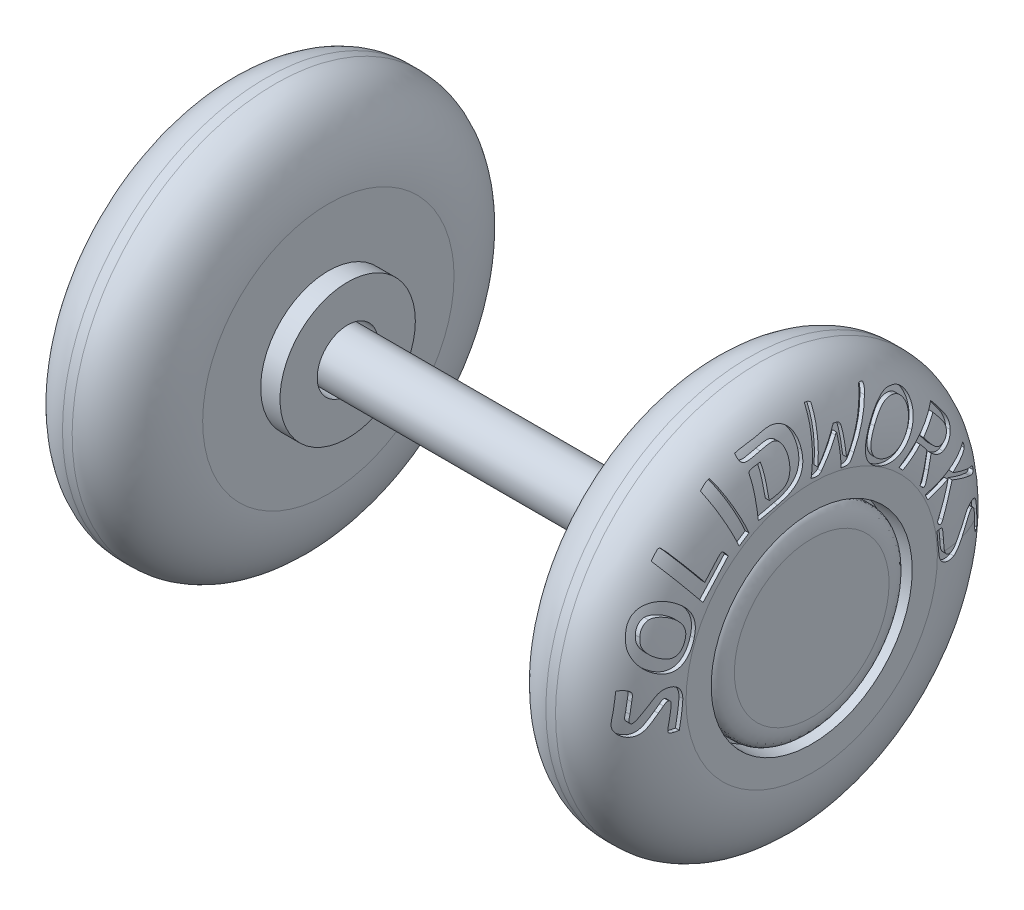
SolidWorks part; units mm, degrees
ref_plane "Front Plane" through (0, 0, 0) normal (0, 0, 1) x (1, 0, 0)
ref_plane "Top Plane" through (0, 0, 0) normal (0, 1, 0) x (1, 0, 0)
ref_plane "Right Plane" through (0, 0, 0) normal (1, 0, 0) x (0, 0, -1)
sketch "Sketch1" plane through (0, 0, 0) normal (1, 0, 0) x (0, 0, -1)
  circle A0 centre (0, 0) radius 1.375
  dimension "D1" = 2.75
extrude "Boss-Extrude1" add sketch "Sketch1" along normal mid plane 31
sketch "Sketch2" plane through (15.5, 0, 0) normal (1, 0, 0) x (0, 0, -1)
  circle A1 centre (0, 0) radius 5
  dimension "D1" = 10
extrude "Boss-Extrude2" add sketch "Sketch2" against normal blind 1
sketch "Sketch3" plane through (-15.5, 0, 0) normal (-1, 0, 0) x (0, 0, 1)
  circle A1 centre (0, 0) radius 5
  circle A2 centre (0, 0) radius 5
  dimension "D1" = 0
extrude "Boss-Extrude3" add sketch "Sketch3" against normal blind 1
fillet "Fillet2" radius 1 2 edges at (-15.5, 0, 5) (15.5, 0, -5)
sketch "Sketch4" plane through (0, 0, 0) normal (0, 1, 0) x (1, 0, 0)
  line L0 (0, 0) -> (0, 7.0257) construction
  line L1 (-15.5, 5.2) -> (-15.5, 10.5)
  line L2 (-14.3, 5.2) -> (-14.3, 1.575)
  line L3 (-15.5, 10.5) -> (-9.5, 10.5)
  line L4 (-9.5, 10.5) -> (-9.5, 3.5)
  line L5 (-9.5, 3.5) -> (-8.5, 3.5)
  line L6 (-8.5, 3.5) -> (-8.5, 1.575)
  line L7 (-8.5, 1.575) -> (-14.3, 1.575)
  line L8 (14.5, 1.375) -> (-14.5, 1.375) construction
  line L10 (-15.5, 5.2) -> (-14.3, 5.2)
  line L11 (-14.5, 5) -> (-15, 5) construction
  line L12 (-14.5, -5) -> (-14.5, 5) construction
  line L13 (9.5, 3.5) -> (8.5, 3.5)
  line L14 (9.5, 10.5) -> (9.5, 3.5)
  line L15 (15.5, 10.5) -> (9.5, 10.5)
  line L16 (15.5, 5.2) -> (15.5, 10.5)
  line L17 (15.5, 5.2) -> (14.3, 5.2)
  line L18 (14.3, 5.2) -> (14.3, 1.575)
  line L19 (8.5, 1.575) -> (14.3, 1.575)
  line L20 (8.5, 3.5) -> (8.5, 1.575)
  line L21 (14.5, 0) -> (-14.5, 0) construction
  dimension "D1" = 0.2
  dimension "D2" = 10.5
  dimension "D3" = 6
  dimension "D4" = 1
  dimension "D5" = 3.5
  dimension "D6" = 0.2
  dimension "D7" = 0.2
  dimension "D8" = 1.2
revolve "Revolve1" add sketch "Sketch4" angle 360 about axis through (15.5, 0, 0) along (-1, 0, 0)
fillet "Fillet3" radius 4 2 edges at (-9.5, 0, -10.5) (-15.5, 0, -10.5)
fillet "Fillet4" radius 4 2 edges at (15.5, 0, -10.5) (9.5, 0, -10.5)
sketch "Sketch6" plane through (15.5, 0, 0) normal (1, 0, 0) x (0, 0, -1)
  line L0 (6.1029, 4.8255) -> (5.607, 3.5743)
  line L1 (-7.0613, -1.1466) -> (-6.8336, -1.1723)
  line L2 (0.511, 6.7706) -> (1.4142, 7.8418)
  line L3 (1.5075, 7.913) -> (1.5267, 6.413)
  line L4 (2.2065, 6.7495) -> (3.3789, 8.4376)
  line L5 (0.3417, 7.0341) -> (0.7813, 9.3258)
  line L6 (0.496, 9.4168) -> (-0.0257, 6.7157)
  line L7 (-5.6069, 3.944) -> (-4.3068, 5.3711)
  line L8 (-5.4773, 4.7616) -> (-6.5379, 6.1298)
  line L9 (-6.7061, 6.3517) -> (-6.8957, 6.5602)
  line L10 (-6.8957, 6.5602) -> (-6.9585, 6.5541)
  line L11 (5.88, 3.018) -> (5.9991, 2.7442)
  line L12 (7.4614, 2.8066) -> (8.7831, 2.1168)
  line L13 (-3.7484, 5.5397) -> (-3.2376, 5.8749)
  line L14 (-4.8596, 8.1146) -> (-3.7484, 5.5397)
  spline S0 degree 3 poles (0.3992, -10.4925) (-5.3947, -10.736) (-10.2888, -6.2365) (-10.5322, -0.4425) knots 0.75 0.75 0.75 0.75 1 1 1 1 construction
  spline S1 degree 3 poles (10.4492, 0.4389) (10.6927, -5.355) (6.1932, -10.2491) (0.3992, -10.4925) knots 0.5 0.5 0.5 0.5 0.75 0.75 0.75 0.75 construction
  spline S2 degree 3 poles (-0.4822, 10.4889) (5.3117, 10.7324) (10.2058, 6.2329) (10.4492, 0.4389) knots 0.25 0.25 0.25 0.25 0.5 0.5 0.5 0.5 construction
  spline S3 degree 3 poles (-10.5322, -0.4425) (-10.7757, 5.3514) (-6.2762, 10.2455) (-0.4822, 10.4889) knots 0 0 0 0 0.25 0.25 0.25 0.25 construction
  spline S4 degree 3 poles (-6.9179, 4.4597) (-7.7414, 4.9473) (-8.523, 4.5972) (-8.7241, 3.6617) knots 0.8 0.8 0.8 0.8 1 1 1 1
  spline S5 degree 3 poles (-6.0745, 2.5995) (-5.8601, 3.4074) (-6.2269, 4.0504) (-6.9179, 4.4597) knots 0.6 0.6 0.6 0.6 0.8 0.8 0.8 0.8
  spline S6 degree 3 poles (-7.8878, 1.7969) (-7.0077, 1.2979) (-6.3236, 1.6614) (-6.0745, 2.5995) knots 0.4 0.4 0.4 0.4 0.6 0.6 0.6 0.6
  spline S7 degree 3 poles (-8.6485, 2.5847) (-8.5019, 2.2707) (-8.2352, 1.994) (-7.8878, 1.7969) knots 0.2 0.2 0.2 0.2 0.4 0.4 0.4 0.4
  spline S8 degree 3 poles (-8.7241, 3.6617) (-8.821, 3.2108) (-8.818, 2.9476) (-8.6485, 2.5847) knots 0 0 0 0 0.2 0.2 0.2 0.2
  spline S9 degree 3 poles (-7.9008, 4.0439) (-8.1052, 3.9583) (-8.261, 3.69) (-8.2994, 3.4278) knots 0.833333 0.833333 0.833333 0.833333 1 1 1 1
  spline S10 degree 3 poles (-6.4874, 2.8623) (-6.3644, 3.63) (-7.4779, 4.2209) (-7.9008, 4.0439) knots 0.666667 0.666667 0.666667 0.666667 0.833333 0.833333 0.833333 0.833333
  spline S11 degree 3 poles (-6.8897, 2.2194) (-6.6867, 2.3078) (-6.5303, 2.5942) (-6.4874, 2.8623) knots 0.5 0.5 0.5 0.5 0.666667 0.666667 0.666667 0.666667
  spline S12 degree 3 poles (-7.629, 2.3456) (-7.3667, 2.2084) (-7.1174, 2.1202) (-6.8897, 2.2194) knots 0.333333 0.333333 0.333333 0.333333 0.5 0.5 0.5 0.5
  spline S13 degree 3 poles (-8.1719, 2.792) (-8.0557, 2.6249) (-7.8439, 2.4579) (-7.629, 2.3456) knots 0.166667 0.166667 0.166667 0.166667 0.333333 0.333333 0.333333 0.333333
  spline S14 degree 3 poles (-8.2994, 3.4278) (-8.341, 3.1427) (-8.3233, 3.01) (-8.1719, 2.792) knots 0 0 0 0 0.166667 0.166667 0.166667 0.166667
  spline S15 degree 3 poles (5.4074, 6.0703) (5.986, 6.7608) (5.869, 7.6502) (5.0413, 7.9491) knots 0.75 0.75 0.75 0.75 1 1 1 1
  spline S16 degree 3 poles (3.5458, 5.4835) (4.2414, 5.1853) (4.9379, 5.5104) (5.4074, 6.0703) knots 0.5 0.5 0.5 0.5 0.75 0.75 0.75 0.75
  spline S17 degree 3 poles (4.0176, 7.9739) (2.9679, 7.6122) (2.1543, 6.08) (3.5458, 5.4835) knots 0.25 0.25 0.25 0.25 0.5 0.5 0.5 0.5
  spline S18 degree 3 poles (5.0413, 7.9491) (4.6119, 8.1045) (4.3605, 8.0924) (4.0176, 7.9739) knots 0 0 0 0 0.25 0.25 0.25 0.25
  spline S19 degree 3 poles (5.4625, 7.0721) (5.4229, 7.3275) (5.2252, 7.5856) (4.9157, 7.6902) knots 0.75 0.75 0.75 0.75 1 1 1 1
  spline S20 degree 3 poles (3.4457, 7.2301) (2.947, 6.6776) (2.9844, 6.0342) (3.6777, 5.7363) (4.6028, 5.3388) (5.562, 6.4291) (5.4625, 7.0721) knots 0.25 0.25 0.25 0.25 0.5 0.5 0.5 0.75 0.75 0.75 0.75
  spline S21 degree 3 poles (4.9157, 7.6902) (4.3046, 7.8966) (3.8526, 7.6813) (3.4457, 7.2301) knots 0 0 0 0 0.25 0.25 0.25 0.25
  spline S22 degree 3 poles (-1.1046, 7.2957) (-1.294, 6.9059) (-1.6495, 6.8612) (-2.1568, 6.773) knots 0.916667 0.916667 0.916667 0.916667 1 1 1 1
  spline S23 degree 3 poles (-1.0506, 8.4509) (-0.925, 8.0791) (-0.9739, 7.5648) (-1.1046, 7.2957) knots 0.833333 0.833333 0.833333 0.833333 0.916667 0.916667 0.916667 0.916667
  spline S24 degree 3 poles (-2.0955, 8.6969) (-1.6056, 8.8053) (-1.2185, 8.9481) (-1.0506, 8.4509) knots 0.75 0.75 0.75 0.75 0.833333 0.833333 0.833333 0.833333
  spline S25 degree 3 poles (-3.0944, 8.928) (-3.0893, 8.3452) (-2.6961, 8.564) (-2.0955, 8.6969) knots 0.666667 0.666667 0.666667 0.666667 0.75 0.75 0.75 0.75
  spline S26 degree 3 poles (-2.0868, 9.1595) (-2.3639, 9.0982) (-2.8492, 9.0203) (-3.0944, 8.928) knots 0.583333 0.583333 0.583333 0.583333 0.666667 0.666667 0.666667 0.666667
  spline S27 degree 3 poles (-1.1479, 9.2899) (-1.4363, 9.3273) (-1.7718, 9.2292) (-2.0868, 9.1595) knots 0.5 0.5 0.5 0.5 0.583333 0.583333 0.583333 0.583333
  spline S28 degree 3 poles (-0.3154, 8.0423) (-0.323, 8.7533) (-0.5581, 9.2134) (-1.1479, 9.2899) knots 0.416667 0.416667 0.416667 0.416667 0.5 0.5 0.5 0.5
  spline S29 degree 3 poles (-1.7636, 6.3938) (-0.8874, 6.5881) (-0.3044, 7.0044) (-0.3154, 8.0423) knots 0.333333 0.333333 0.333333 0.333333 0.416667 0.416667 0.416667 0.416667
  spline S30 degree 3 poles (-2.7479, 6.1817) (-2.4783, 6.2086) (-2.045, 6.3313) (-1.7636, 6.3938) knots 0.25 0.25 0.25 0.25 0.333333 0.333333 0.333333 0.333333
  spline S31 degree 3 poles (-2.8102, 7.7234) (-2.8023, 7.4534) (-2.7797, 6.2956) (-2.7479, 6.1817) knots 0.166667 0.166667 0.166667 0.166667 0.25 0.25 0.25 0.25
  spline S32 degree 3 poles (-2.241, 8.3428) (-2.9459, 8.2084) (-2.8266, 8.2783) (-2.8102, 7.7234) knots 0.083333 0.083333 0.083333 0.083333 0.166667 0.166667 0.166667 0.166667
  spline S33 degree 3 poles (-2.1568, 6.773) (-2.2239, 6.9953) (-2.1793, 8.0916) (-2.241, 8.3428) knots 0 0 0 0 0.083333 0.083333 0.083333 0.083333
  spline S34 degree 3 poles (4.5205, 4.9315) (4.5781, 4.856) (4.6436, 4.7606) (4.7071, 4.723) knots 0 0 0 0 0.090909 0.090909 0.090909 0.090909
  spline S35 degree 3 poles (4.7071, 4.723) (4.8292, 4.7508) (5.5778, 5.1717) (5.7563, 5.2738) knots 0.090909 0.090909 0.090909 0.090909 0.181818 0.181818 0.181818 0.181818
  spline S36 degree 3 poles (5.7563, 5.2738) (5.85, 5.1714) (6.0474, 4.9423) (6.1029, 4.8255) knots 0.181818 0.181818 0.181818 0.181818 0.272727 0.272727 0.272727 0.272727
  spline S37 degree 3 poles (5.607, 3.5743) (5.857, 3.2188) (5.887, 3.45) (6.086, 3.9827) knots 0.363636 0.363636 0.363636 0.363636 0.454545 0.454545 0.454545 0.454545
  spline S38 degree 3 poles (6.086, 3.9827) (6.1139, 4.0577) (6.2849, 4.5428) (6.3401, 4.5841) knots 0.454545 0.454545 0.454545 0.454545 0.545455 0.545455 0.545455 0.545455
  spline S39 degree 3 poles (6.3401, 4.5841) (6.5768, 4.3639) (6.7974, 4.2451) (7.0742, 4.2494) knots 0.545455 0.545455 0.545455 0.545455 0.636364 0.636364 0.636364 0.636364
  spline S40 degree 3 poles (7.0742, 4.2494) (7.3146, 4.2533) (7.6813, 4.3669) (7.8225, 4.651) knots 0.636364 0.636364 0.636364 0.636364 0.727273 0.727273 0.727273 0.727273
  spline S41 degree 3 poles (7.8225, 4.651) (7.9527, 4.9131) (7.8289, 5.1654) (7.6466, 5.4411) knots 0.727273 0.727273 0.727273 0.727273 0.818182 0.818182 0.818182 0.818182
  spline S42 degree 3 poles (7.6466, 5.4411) (7.5407, 5.6017) (7.131, 6.1415) (6.9928, 6.2663) knots 0.818182 0.818182 0.818182 0.818182 0.909091 0.909091 0.909091 0.909091
  spline S43 degree 3 poles (6.9928, 6.2663) (6.8208, 6.1817) (4.6651, 5.0454) (4.5205, 4.9315) knots 0.909091 0.909091 0.909091 0.909091 1 1 1 1
  spline S44 degree 3 poles (6.9166, 5.8843) (6.8467, 5.8739) (6.0979, 5.4779) (6.0149, 5.4092) knots 0.75 0.75 0.75 0.75 1 1 1 1
  spline S45 degree 3 poles (7.4391, 5.226) (7.2881, 5.4422) (7.088, 5.6812) (6.9166, 5.8843) knots 0.5 0.5 0.5 0.5 0.75 0.75 0.75 0.75
  spline S46 degree 3 poles (6.7909, 4.6031) (7.1974, 4.4198) (7.8197, 4.6811) (7.4391, 5.226) knots 0.25 0.25 0.25 0.25 0.5 0.5 0.5 0.5
  spline S47 degree 3 poles (6.0149, 5.4092) (6.2194, 5.1389) (6.5098, 4.7298) (6.7909, 4.6031) knots 0 0 0 0 0.25 0.25 0.25 0.25
  spline S48 degree 3 poles (-6.8336, -1.1723) (-6.7814, -0.9232) (-6.6579, -0.0611) (-6.6624, 0.1686) knots 0.058824 0.058824 0.058824 0.058824 0.117647 0.117647 0.117647 0.117647
  spline S49 degree 3 poles (-6.6624, 0.1686) (-6.6695, 0.5259) (-6.8522, 0.8552) (-7.224, 0.943) knots 0.117647 0.117647 0.117647 0.117647 0.176471 0.176471 0.176471 0.176471
  spline S50 degree 3 poles (-7.224, 0.943) (-7.8004, 1.0792) (-7.9809, 0.6757) (-8.463, 0.1744) knots 0.176471 0.176471 0.176471 0.176471 0.235294 0.235294 0.235294 0.235294
  spline S51 degree 3 poles (-8.463, 0.1744) (-8.5419, 0.0923) (-8.708, -0.1408) (-8.8313, -0.1444) knots 0.235294 0.235294 0.235294 0.235294 0.294118 0.294118 0.294118 0.294118
  spline S52 degree 3 poles (-8.8313, -0.1444) (-8.9505, -0.0578) (-8.8886, 0.1179) (-8.8658, 0.2914) knots 0.294118 0.294118 0.294118 0.294118 0.352941 0.352941 0.352941 0.352941
  spline S53 degree 3 poles (-8.8658, 0.2914) (-8.8423, 0.4704) (-8.8189, 0.6495) (-8.7953, 0.8285) knots 0.352941 0.352941 0.352941 0.352941 0.411765 0.411765 0.411765 0.411765
  spline S54 degree 3 poles (-8.7953, 0.8285) (-8.7706, 1.0162) (-8.7163, 1.159) (-8.8209, 1.268) knots 0.411765 0.411765 0.411765 0.411765 0.470588 0.470588 0.470588 0.470588
  spline S55 degree 3 poles (-8.8209, 1.268) (-8.9228, 1.3742) (-9.1168, 1.3875) (-9.2834, 1.3998) knots 0.470588 0.470588 0.470588 0.470588 0.529412 0.529412 0.529412 0.529412
  spline S56 degree 3 poles (-9.2834, 1.3998) (-9.3303, 1.1007) (-9.3649, 0.7939) (-9.4043, 0.4932) knots 0.529412 0.529412 0.529412 0.529412 0.588235 0.588235 0.588235 0.588235
  spline S57 degree 3 poles (-9.4043, 0.4932) (-9.4428, 0.1999) (-9.5281, -0.11) (-9.4075, -0.3409) knots 0.588235 0.588235 0.588235 0.588235 0.647059 0.647059 0.647059 0.647059
  spline S58 degree 3 poles (-9.4075, -0.3409) (-9.3164, -0.5155) (-9.1312, -0.6955) (-8.8653, -0.7342) knots 0.647059 0.647059 0.647059 0.647059 0.705882 0.705882 0.705882 0.705882
  spline S59 degree 3 poles (-8.8653, -0.7342) (-8.3947, -0.8029) (-8.1519, -0.4008) (-7.7878, 0.0009) knots 0.705882 0.705882 0.705882 0.705882 0.764706 0.764706 0.764706 0.764706
  spline S60 degree 3 poles (-7.7878, 0.0009) (-7.7168, 0.0792) (-7.6509, 0.1522) (-7.5688, 0.242) knots 0.764706 0.764706 0.764706 0.764706 0.823529 0.823529 0.823529 0.823529
  spline S61 degree 3 poles (-7.5688, 0.242) (-7.5175, 0.298) (-7.3967, 0.4611) (-7.266, 0.3373) knots 0.823529 0.823529 0.823529 0.823529 0.882353 0.882353 0.882353 0.882353
  spline S62 degree 3 poles (-7.266, 0.3373) (-7.1346, 0.2129) (-7.3728, -0.6948) (-7.3638, -0.9539) knots 0.882353 0.882353 0.882353 0.882353 0.941176 0.941176 0.941176 0.941176
  spline S63 degree 3 poles (-7.3638, -0.9539) (-7.3583, -1.1108) (-7.2331, -1.1244) (-7.0613, -1.1466) knots 0.941176 0.941176 0.941176 0.941176 1 1 1 1
  spline S64 degree 3 poles (-0.0257, 6.7157) (0.2244, 6.6356) (0.3619, 6.626) (0.511, 6.7706) knots 0 0 0 0 0.058824 0.058824 0.058824 0.058824
  spline S65 degree 3 poles (1.4142, 7.8418) (1.4574, 7.8918) (1.4527, 7.9041) (1.5075, 7.913) knots 0.117647 0.117647 0.117647 0.117647 0.176471 0.176471 0.176471 0.176471
  spline S66 degree 3 poles (1.5267, 6.413) (1.9858, 6.3087) (1.9969, 6.4409) (2.2065, 6.7495) knots 0.235294 0.235294 0.235294 0.235294 0.294118 0.294118 0.294118 0.294118
  spline S67 degree 3 poles (3.3789, 8.4376) (3.4544, 8.5434) (3.5727, 8.6647) (3.5619, 8.8092) knots 0.352941 0.352941 0.352941 0.352941 0.411765 0.411765 0.411765 0.411765
  spline S68 degree 3 poles (3.5619, 8.8092) (3.5091, 8.8404) (3.4648, 8.8636) (3.3917, 8.8663) knots 0.411765 0.411765 0.411765 0.411765 0.470588 0.470588 0.470588 0.470588
  spline S69 degree 3 poles (3.3917, 8.8663) (3.3352, 8.8683) (3.3524, 8.8652) (3.3333, 8.8608) knots 0.470588 0.470588 0.470588 0.470588 0.529412 0.529412 0.529412 0.529412
  spline S70 degree 3 poles (3.3333, 8.8608) (3.2465, 8.7939) (2.7052, 7.9683) (2.5883, 7.7992) knots 0.529412 0.529412 0.529412 0.529412 0.588235 0.588235 0.588235 0.588235
  spline S71 degree 3 poles (2.5883, 7.7992) (2.4691, 7.6268) (1.9258, 6.803) (1.8325, 6.7327) knots 0.588235 0.588235 0.588235 0.588235 0.647059 0.647059 0.647059 0.647059
  spline S72 degree 3 poles (1.8325, 6.7327) (1.7842, 6.857) (1.8208, 7.8093) (1.791, 8.0576) knots 0.647059 0.647059 0.647059 0.647059 0.705882 0.705882 0.705882 0.705882
  spline S73 degree 3 poles (1.791, 8.0576) (1.7687, 8.2439) (1.6376, 8.2515) (1.4431, 8.2843) knots 0.705882 0.705882 0.705882 0.705882 0.764706 0.764706 0.764706 0.764706
  spline S74 degree 3 poles (1.4431, 8.2843) (1.2804, 8.1214) (0.4388, 7.0813) (0.3417, 7.0341) knots 0.764706 0.764706 0.764706 0.764706 0.823529 0.823529 0.823529 0.823529
  spline S75 degree 3 poles (0.7813, 9.3258) (0.6736, 9.4055) (0.6319, 9.409) (0.496, 9.4168) knots 0.882353 0.882353 0.882353 0.882353 0.941176 0.941176 0.941176 0.941176
  spline S76 degree 3 poles (-4.3068, 5.3711) (-4.3388, 5.4454) (-4.4992, 5.6292) (-4.5846, 5.6793) knots 0.111111 0.111111 0.111111 0.111111 0.222222 0.222222 0.222222 0.222222
  spline S77 degree 3 poles (-4.5846, 5.6793) (-4.7959, 5.5948) (-5.2612, 4.9626) (-5.4773, 4.7616) knots 0.222222 0.222222 0.222222 0.222222 0.333333 0.333333 0.333333 0.333333
  spline S78 degree 3 poles (-6.5379, 6.1298) (-6.5926, 6.2043) (-6.6428, 6.2703) (-6.7061, 6.3517) knots 0.444444 0.444444 0.444444 0.444444 0.555556 0.555556 0.555556 0.555556
  spline S79 degree 3 poles (-6.9585, 6.5541) (-7.0231, 6.5175) (-7.2824, 6.2152) (-7.3174, 6.163) knots 0.777778 0.777778 0.777778 0.777778 0.888889 0.888889 0.888889 0.888889
  spline S80 degree 3 poles (-7.3174, 6.163) (-7.2761, 6.0738) (-5.6726, 3.9929) (-5.6069, 3.944) knots 0.888889 0.888889 0.888889 0.888889 1 1 1 1
  spline S81 degree 3 poles (5.9991, 2.7442) (6.2125, 2.7982) (7.0754, 3.0087) (7.1875, 2.9876) knots 0.076923 0.076923 0.076923 0.076923 0.153846 0.153846 0.153846 0.153846
  spline S82 degree 3 poles (7.1875, 2.9876) (7.1706, 2.8513) (6.5821, 1.7179) (6.5273, 1.5524) knots 0.153846 0.153846 0.153846 0.153846 0.230769 0.230769 0.230769 0.230769
  spline S83 degree 3 poles (6.5273, 1.5524) (6.473, 1.3882) (6.6706, 1.1651) (6.795, 1.4411) knots 0.230769 0.230769 0.230769 0.230769 0.307692 0.307692 0.307692 0.307692
  spline S84 degree 3 poles (6.795, 1.4411) (6.8928, 1.6582) (7.3573, 2.7299) (7.4614, 2.8066) knots 0.307692 0.307692 0.307692 0.307692 0.384615 0.384615 0.384615 0.384615
  spline S85 degree 3 poles (8.7831, 2.1168) (8.9274, 2.0418) (9.1915, 1.864) (9.2536, 2.0149) knots 0.461538 0.461538 0.461538 0.461538 0.538462 0.538462 0.538462 0.538462
  spline S86 degree 3 poles (9.2536, 2.0149) (9.2761, 2.2494) (9.0497, 2.3023) (8.9063, 2.3736) knots 0.538462 0.538462 0.538462 0.538462 0.615385 0.615385 0.615385 0.615385
  spline S87 degree 3 poles (8.9063, 2.3736) (8.7322, 2.4602) (7.618, 3.0133) (7.5558, 3.0686) knots 0.615385 0.615385 0.615385 0.615385 0.692308 0.692308 0.692308 0.692308
  spline S88 degree 3 poles (7.5558, 3.0686) (7.8271, 3.1822) (8.4662, 3.222) (8.6721, 3.3649) knots 0.692308 0.692308 0.692308 0.692308 0.769231 0.769231 0.769231 0.769231
  spline S89 degree 3 poles (8.6721, 3.3649) (8.7046, 3.4684) (8.6892, 3.4794) (8.6355, 3.6032) knots 0.769231 0.769231 0.769231 0.769231 0.846154 0.846154 0.846154 0.846154
  spline S90 degree 3 poles (8.6355, 3.6032) (8.4956, 3.6002) (6.894, 3.2417) (6.5918, 3.1835) knots 0.846154 0.846154 0.846154 0.846154 0.923077 0.923077 0.923077 0.923077
  spline S91 degree 3 poles (6.5918, 3.1835) (6.4237, 3.1511) (6.0358, 3.0828) (5.88, 3.018) knots 0.923077 0.923077 0.923077 0.923077 1 1 1 1
  spline S92 degree 3 poles (6.8287, 0.5149) (6.7645, 1.1897) (6.8189, 1.1525) (6.482, 1.0952) knots 0.928571 0.928571 0.928571 0.928571 1 1 1 1
  spline S93 degree 3 poles (7.0337, -0.2161) (6.8268, -0.0955) (6.8529, 0.2604) (6.8287, 0.5149) knots 0.857143 0.857143 0.857143 0.857143 0.928571 0.928571 0.928571 0.928571
  spline S94 degree 3 poles (7.5957, 0.0325) (7.4972, -0.0908) (7.2908, -0.3659) (7.0337, -0.2161) knots 0.785714 0.785714 0.785714 0.785714 0.857143 0.857143 0.857143 0.857143
  spline S95 degree 3 poles (7.9801, 0.5096) (7.8367, 0.3304) (7.7386, 0.2114) (7.5957, 0.0325) knots 0.714286 0.714286 0.714286 0.714286 0.785714 0.785714 0.785714 0.785714
  spline S96 degree 3 poles (8.4137, 0.9654) (8.2511, 0.8754) (8.0851, 0.6407) (7.9801, 0.5096) knots 0.642857 0.642857 0.642857 0.642857 0.714286 0.714286 0.714286 0.714286
  spline S97 degree 3 poles (9.1117, 0.9214) (8.9501, 1.045) (8.6276, 1.0839) (8.4137, 0.9654) knots 0.571429 0.571429 0.571429 0.571429 0.642857 0.642857 0.642857 0.642857
  spline S98 degree 3 poles (9.3459, 0.2272) (9.3182, 0.5246) (9.3014, 0.7763) (9.1117, 0.9214) knots 0.5 0.5 0.5 0.5 0.571429 0.571429 0.571429 0.571429
  spline S99 degree 3 poles (9.42, -0.6244) (9.4224, -0.3776) (9.3698, -0.0287) (9.3459, 0.2272) knots 0.428571 0.428571 0.428571 0.428571 0.5 0.5 0.5 0.5
  spline S100 degree 3 poles (9.1439, -0.6187) (9.2186, -0.6664) (9.3142, -0.6483) (9.42, -0.6244) knots 0.357143 0.357143 0.357143 0.357143 0.428571 0.428571 0.428571 0.428571
  spline S101 degree 3 poles (8.7169, 0.7325) (9.2271, 0.745) (8.978, -0.2789) (9.1439, -0.6187) knots 0.285714 0.285714 0.285714 0.285714 0.357143 0.357143 0.357143 0.357143
  spline S102 degree 3 poles (7.4251, -0.5187) (7.8646, -0.3442) (8.349, 0.7235) (8.7169, 0.7325) knots 0.214286 0.214286 0.214286 0.214286 0.285714 0.285714 0.285714 0.285714
  spline S103 degree 3 poles (6.7662, -0.4171) (6.9206, -0.5527) (7.2043, -0.6064) (7.4251, -0.5187) knots 0.142857 0.142857 0.142857 0.142857 0.214286 0.214286 0.214286 0.214286
  spline S104 degree 3 poles (6.556, 0.2719) (6.5824, -0.013) (6.5744, -0.2487) (6.7662, -0.4171) knots 0.071429 0.071429 0.071429 0.071429 0.142857 0.142857 0.142857 0.142857
  spline S105 degree 3 poles (6.482, 1.0952) (6.4941, 0.8279) (6.5311, 0.5405) (6.556, 0.2719) knots 0 0 0 0 0.071429 0.071429 0.071429 0.071429
  spline S106 degree 3 poles (-3.2376, 5.8749) (-3.3156, 6.0908) (-4.3084, 8.4061) (-4.3804, 8.4185) knots 0.25 0.25 0.25 0.25 0.5 0.5 0.5 0.5
  spline S107 degree 3 poles (-4.3804, 8.4185) (-4.5008, 8.3922) (-4.7439, 8.2114) (-4.8596, 8.1146) knots 0.5 0.5 0.5 0.5 0.75 0.75 0.75 0.75
extrude "Cut-Extrude3" cut sketch "Sketch6" against normal offset from surface (0.4358 mm away) 0.2
sketch "Sketch7" plane through (-15.5, 0, 0) normal (-1, 0, 0) x (0, 0, 1)
  line L0 (6.1324, 4.8268) -> (5.6365, 3.5756)
  line L1 (-7.0318, -1.1453) -> (-6.8041, -1.171)
  line L2 (0.5405, 6.7719) -> (1.4437, 7.8431)
  line L3 (1.537, 7.9143) -> (1.5562, 6.4143)
  line L4 (2.236, 6.7508) -> (3.4084, 8.4389)
  line L5 (0.3712, 7.0354) -> (0.8108, 9.3271)
  line L6 (0.5255, 9.4181) -> (0.0038, 6.717)
  line L7 (-5.5774, 3.9453) -> (-4.2773, 5.3724)
  line L8 (-5.4478, 4.7629) -> (-6.5084, 6.1311)
  line L9 (-6.6766, 6.353) -> (-6.8662, 6.5615)
  line L10 (-6.8662, 6.5615) -> (-6.929, 6.5554)
  line L11 (5.9095, 3.0193) -> (6.0286, 2.7455)
  line L12 (7.4909, 2.8079) -> (8.8126, 2.1181)
  line L13 (-3.7189, 5.541) -> (-3.2081, 5.8762)
  line L14 (-4.8301, 8.1159) -> (-3.7189, 5.541)
  spline S0 degree 3 poles (0.4287, -10.4912) (-5.3652, -10.7347) (-10.2593, -6.2352) (-10.5027, -0.4412) knots 0.75 0.75 0.75 0.75 1 1 1 1 construction
  spline S1 degree 3 poles (10.4787, 0.4402) (10.7222, -5.3537) (6.2227, -10.2478) (0.4287, -10.4912) knots 0.5 0.5 0.5 0.5 0.75 0.75 0.75 0.75 construction
  spline S2 degree 3 poles (-0.4527, 10.4902) (5.3412, 10.7337) (10.2353, 6.2342) (10.4787, 0.4402) knots 0.25 0.25 0.25 0.25 0.5 0.5 0.5 0.5 construction
  spline S3 degree 3 poles (-10.5027, -0.4412) (-10.7462, 5.3527) (-6.2467, 10.2468) (-0.4527, 10.4902) knots 0 0 0 0 0.25 0.25 0.25 0.25 construction
  spline S4 degree 3 poles (-6.8884, 4.461) (-7.7119, 4.9486) (-8.4935, 4.5985) (-8.6946, 3.663) knots 0.8 0.8 0.8 0.8 1 1 1 1
  spline S5 degree 3 poles (-6.045, 2.6008) (-5.8306, 3.4087) (-6.1974, 4.0517) (-6.8884, 4.461) knots 0.6 0.6 0.6 0.6 0.8 0.8 0.8 0.8
  spline S6 degree 3 poles (-7.8583, 1.7982) (-6.9782, 1.2992) (-6.2941, 1.6627) (-6.045, 2.6008) knots 0.4 0.4 0.4 0.4 0.6 0.6 0.6 0.6
  spline S7 degree 3 poles (-8.619, 2.586) (-8.4724, 2.272) (-8.2057, 1.9953) (-7.8583, 1.7982) knots 0.2 0.2 0.2 0.2 0.4 0.4 0.4 0.4
  spline S8 degree 3 poles (-8.6946, 3.663) (-8.7915, 3.2121) (-8.7885, 2.9489) (-8.619, 2.586) knots 0 0 0 0 0.2 0.2 0.2 0.2
  spline S9 degree 3 poles (-7.8713, 4.0452) (-8.0757, 3.9596) (-8.2315, 3.6913) (-8.2699, 3.4291) knots 0.833333 0.833333 0.833333 0.833333 1 1 1 1
  spline S10 degree 3 poles (-6.4579, 2.8636) (-6.3349, 3.6313) (-7.4484, 4.2222) (-7.8713, 4.0452) knots 0.666667 0.666667 0.666667 0.666667 0.833333 0.833333 0.833333 0.833333
  spline S11 degree 3 poles (-6.8602, 2.2207) (-6.6572, 2.3091) (-6.5008, 2.5955) (-6.4579, 2.8636) knots 0.5 0.5 0.5 0.5 0.666667 0.666667 0.666667 0.666667
  spline S12 degree 3 poles (-7.5995, 2.3469) (-7.3372, 2.2097) (-7.0879, 2.1215) (-6.8602, 2.2207) knots 0.333333 0.333333 0.333333 0.333333 0.5 0.5 0.5 0.5
  spline S13 degree 3 poles (-8.1424, 2.7933) (-8.0262, 2.6262) (-7.8144, 2.4592) (-7.5995, 2.3469) knots 0.166667 0.166667 0.166667 0.166667 0.333333 0.333333 0.333333 0.333333
  spline S14 degree 3 poles (-8.2699, 3.4291) (-8.3115, 3.144) (-8.2938, 3.0113) (-8.1424, 2.7933) knots 0 0 0 0 0.166667 0.166667 0.166667 0.166667
  spline S15 degree 3 poles (5.4369, 6.0716) (6.0155, 6.7621) (5.8985, 7.6515) (5.0708, 7.9504) knots 0.75 0.75 0.75 0.75 1 1 1 1
  spline S16 degree 3 poles (3.5753, 5.4848) (4.2709, 5.1866) (4.9674, 5.5117) (5.4369, 6.0716) knots 0.5 0.5 0.5 0.5 0.75 0.75 0.75 0.75
  spline S17 degree 3 poles (4.0471, 7.9752) (2.9974, 7.6135) (2.1838, 6.0813) (3.5753, 5.4848) knots 0.25 0.25 0.25 0.25 0.5 0.5 0.5 0.5
  spline S18 degree 3 poles (5.0708, 7.9504) (4.6414, 8.1058) (4.39, 8.0937) (4.0471, 7.9752) knots 0 0 0 0 0.25 0.25 0.25 0.25
  spline S19 degree 3 poles (5.492, 7.0734) (5.4524, 7.3288) (5.2547, 7.5869) (4.9452, 7.6915) knots 0.75 0.75 0.75 0.75 1 1 1 1
  spline S20 degree 3 poles (3.4752, 7.2314) (2.9765, 6.6789) (3.0139, 6.0355) (3.7072, 5.7376) (4.6323, 5.3401) (5.5915, 6.4304) (5.492, 7.0734) knots 0.25 0.25 0.25 0.25 0.5 0.5 0.5 0.75 0.75 0.75 0.75
  spline S21 degree 3 poles (4.9452, 7.6915) (4.3341, 7.8979) (3.8821, 7.6826) (3.4752, 7.2314) knots 0 0 0 0 0.25 0.25 0.25 0.25
  spline S22 degree 3 poles (-1.0751, 7.297) (-1.2645, 6.9072) (-1.62, 6.8625) (-2.1273, 6.7743) knots 0.916667 0.916667 0.916667 0.916667 1 1 1 1
  spline S23 degree 3 poles (-1.0211, 8.4522) (-0.8955, 8.0804) (-0.9444, 7.5661) (-1.0751, 7.297) knots 0.833333 0.833333 0.833333 0.833333 0.916667 0.916667 0.916667 0.916667
  spline S24 degree 3 poles (-2.066, 8.6982) (-1.5761, 8.8066) (-1.189, 8.9494) (-1.0211, 8.4522) knots 0.75 0.75 0.75 0.75 0.833333 0.833333 0.833333 0.833333
  spline S25 degree 3 poles (-3.0649, 8.9293) (-3.0598, 8.3465) (-2.6666, 8.5653) (-2.066, 8.6982) knots 0.666667 0.666667 0.666667 0.666667 0.75 0.75 0.75 0.75
  spline S26 degree 3 poles (-2.0573, 9.1608) (-2.3344, 9.0995) (-2.8197, 9.0216) (-3.0649, 8.9293) knots 0.583333 0.583333 0.583333 0.583333 0.666667 0.666667 0.666667 0.666667
  spline S27 degree 3 poles (-1.1184, 9.2912) (-1.4068, 9.3286) (-1.7423, 9.2305) (-2.0573, 9.1608) knots 0.5 0.5 0.5 0.5 0.583333 0.583333 0.583333 0.583333
  spline S28 degree 3 poles (-0.2859, 8.0436) (-0.2935, 8.7546) (-0.5286, 9.2147) (-1.1184, 9.2912) knots 0.416667 0.416667 0.416667 0.416667 0.5 0.5 0.5 0.5
  spline S29 degree 3 poles (-1.7341, 6.3951) (-0.8579, 6.5894) (-0.2749, 7.0057) (-0.2859, 8.0436) knots 0.333333 0.333333 0.333333 0.333333 0.416667 0.416667 0.416667 0.416667
  spline S30 degree 3 poles (-2.7184, 6.183) (-2.4488, 6.2099) (-2.0155, 6.3326) (-1.7341, 6.3951) knots 0.25 0.25 0.25 0.25 0.333333 0.333333 0.333333 0.333333
  spline S31 degree 3 poles (-2.7807, 7.7247) (-2.7728, 7.4547) (-2.7502, 6.2969) (-2.7184, 6.183) knots 0.166667 0.166667 0.166667 0.166667 0.25 0.25 0.25 0.25
  spline S32 degree 3 poles (-2.2115, 8.3441) (-2.9164, 8.2097) (-2.7971, 8.2796) (-2.7807, 7.7247) knots 0.083333 0.083333 0.083333 0.083333 0.166667 0.166667 0.166667 0.166667
  spline S33 degree 3 poles (-2.1273, 6.7743) (-2.1944, 6.9966) (-2.1498, 8.0929) (-2.2115, 8.3441) knots 0 0 0 0 0.083333 0.083333 0.083333 0.083333
  spline S34 degree 3 poles (4.55, 4.9328) (4.6076, 4.8573) (4.6731, 4.7619) (4.7366, 4.7243) knots 0 0 0 0 0.090909 0.090909 0.090909 0.090909
  spline S35 degree 3 poles (4.7366, 4.7243) (4.8587, 4.7521) (5.6073, 5.173) (5.7858, 5.2751) knots 0.090909 0.090909 0.090909 0.090909 0.181818 0.181818 0.181818 0.181818
  spline S36 degree 3 poles (5.7858, 5.2751) (5.8795, 5.1727) (6.0769, 4.9436) (6.1324, 4.8268) knots 0.181818 0.181818 0.181818 0.181818 0.272727 0.272727 0.272727 0.272727
  spline S37 degree 3 poles (5.6365, 3.5756) (5.8865, 3.2201) (5.9165, 3.4513) (6.1155, 3.984) knots 0.363636 0.363636 0.363636 0.363636 0.454545 0.454545 0.454545 0.454545
  spline S38 degree 3 poles (6.1155, 3.984) (6.1434, 4.059) (6.3144, 4.5441) (6.3696, 4.5854) knots 0.454545 0.454545 0.454545 0.454545 0.545455 0.545455 0.545455 0.545455
  spline S39 degree 3 poles (6.3696, 4.5854) (6.6063, 4.3652) (6.8269, 4.2464) (7.1037, 4.2507) knots 0.545455 0.545455 0.545455 0.545455 0.636364 0.636364 0.636364 0.636364
  spline S40 degree 3 poles (7.1037, 4.2507) (7.3441, 4.2546) (7.7108, 4.3682) (7.852, 4.6523) knots 0.636364 0.636364 0.636364 0.636364 0.727273 0.727273 0.727273 0.727273
  spline S41 degree 3 poles (7.852, 4.6523) (7.9822, 4.9144) (7.8584, 5.1667) (7.6761, 5.4424) knots 0.727273 0.727273 0.727273 0.727273 0.818182 0.818182 0.818182 0.818182
  spline S42 degree 3 poles (7.6761, 5.4424) (7.5702, 5.603) (7.1605, 6.1428) (7.0223, 6.2676) knots 0.818182 0.818182 0.818182 0.818182 0.909091 0.909091 0.909091 0.909091
  spline S43 degree 3 poles (7.0223, 6.2676) (6.8503, 6.183) (4.6946, 5.0467) (4.55, 4.9328) knots 0.909091 0.909091 0.909091 0.909091 1 1 1 1
  spline S44 degree 3 poles (6.9461, 5.8856) (6.8762, 5.8752) (6.1274, 5.4792) (6.0444, 5.4105) knots 0.75 0.75 0.75 0.75 1 1 1 1
  spline S45 degree 3 poles (7.4686, 5.2273) (7.3176, 5.4435) (7.1175, 5.6825) (6.9461, 5.8856) knots 0.5 0.5 0.5 0.5 0.75 0.75 0.75 0.75
  spline S46 degree 3 poles (6.8204, 4.6044) (7.2269, 4.4211) (7.8492, 4.6824) (7.4686, 5.2273) knots 0.25 0.25 0.25 0.25 0.5 0.5 0.5 0.5
  spline S47 degree 3 poles (6.0444, 5.4105) (6.2489, 5.1402) (6.5393, 4.7311) (6.8204, 4.6044) knots 0 0 0 0 0.25 0.25 0.25 0.25
  spline S48 degree 3 poles (-6.8041, -1.171) (-6.7519, -0.9219) (-6.6284, -0.0598) (-6.6329, 0.1699) knots 0.058824 0.058824 0.058824 0.058824 0.117647 0.117647 0.117647 0.117647
  spline S49 degree 3 poles (-6.6329, 0.1699) (-6.64, 0.5272) (-6.8227, 0.8565) (-7.1945, 0.9443) knots 0.117647 0.117647 0.117647 0.117647 0.176471 0.176471 0.176471 0.176471
  spline S50 degree 3 poles (-7.1945, 0.9443) (-7.7709, 1.0805) (-7.9514, 0.677) (-8.4335, 0.1757) knots 0.176471 0.176471 0.176471 0.176471 0.235294 0.235294 0.235294 0.235294
  spline S51 degree 3 poles (-8.4335, 0.1757) (-8.5124, 0.0936) (-8.6785, -0.1395) (-8.8018, -0.1431) knots 0.235294 0.235294 0.235294 0.235294 0.294118 0.294118 0.294118 0.294118
  spline S52 degree 3 poles (-8.8018, -0.1431) (-8.921, -0.0565) (-8.8591, 0.1192) (-8.8363, 0.2927) knots 0.294118 0.294118 0.294118 0.294118 0.352941 0.352941 0.352941 0.352941
  spline S53 degree 3 poles (-8.8363, 0.2927) (-8.8128, 0.4717) (-8.7894, 0.6508) (-8.7658, 0.8298) knots 0.352941 0.352941 0.352941 0.352941 0.411765 0.411765 0.411765 0.411765
  spline S54 degree 3 poles (-8.7658, 0.8298) (-8.7411, 1.0175) (-8.6868, 1.1603) (-8.7914, 1.2693) knots 0.411765 0.411765 0.411765 0.411765 0.470588 0.470588 0.470588 0.470588
  spline S55 degree 3 poles (-8.7914, 1.2693) (-8.8933, 1.3755) (-9.0873, 1.3888) (-9.2539, 1.4011) knots 0.470588 0.470588 0.470588 0.470588 0.529412 0.529412 0.529412 0.529412
  spline S56 degree 3 poles (-9.2539, 1.4011) (-9.3008, 1.102) (-9.3354, 0.7952) (-9.3748, 0.4945) knots 0.529412 0.529412 0.529412 0.529412 0.588235 0.588235 0.588235 0.588235
  spline S57 degree 3 poles (-9.3748, 0.4945) (-9.4133, 0.2012) (-9.4986, -0.1087) (-9.378, -0.3396) knots 0.588235 0.588235 0.588235 0.588235 0.647059 0.647059 0.647059 0.647059
  spline S58 degree 3 poles (-9.378, -0.3396) (-9.2869, -0.5142) (-9.1017, -0.6942) (-8.8358, -0.7329) knots 0.647059 0.647059 0.647059 0.647059 0.705882 0.705882 0.705882 0.705882
  spline S59 degree 3 poles (-8.8358, -0.7329) (-8.3652, -0.8016) (-8.1224, -0.3995) (-7.7583, 0.0022) knots 0.705882 0.705882 0.705882 0.705882 0.764706 0.764706 0.764706 0.764706
  spline S60 degree 3 poles (-7.7583, 0.0022) (-7.6873, 0.0805) (-7.6214, 0.1535) (-7.5393, 0.2433) knots 0.764706 0.764706 0.764706 0.764706 0.823529 0.823529 0.823529 0.823529
  spline S61 degree 3 poles (-7.5393, 0.2433) (-7.488, 0.2993) (-7.3672, 0.4624) (-7.2365, 0.3386) knots 0.823529 0.823529 0.823529 0.823529 0.882353 0.882353 0.882353 0.882353
  spline S62 degree 3 poles (-7.2365, 0.3386) (-7.1051, 0.2142) (-7.3433, -0.6935) (-7.3343, -0.9526) knots 0.882353 0.882353 0.882353 0.882353 0.941176 0.941176 0.941176 0.941176
  spline S63 degree 3 poles (-7.3343, -0.9526) (-7.3288, -1.1095) (-7.2036, -1.1231) (-7.0318, -1.1453) knots 0.941176 0.941176 0.941176 0.941176 1 1 1 1
  spline S64 degree 3 poles (0.0038, 6.717) (0.2539, 6.6369) (0.3914, 6.6273) (0.5405, 6.7719) knots 0 0 0 0 0.058824 0.058824 0.058824 0.058824
  spline S65 degree 3 poles (1.4437, 7.8431) (1.4869, 7.8931) (1.4822, 7.9054) (1.537, 7.9143) knots 0.117647 0.117647 0.117647 0.117647 0.176471 0.176471 0.176471 0.176471
  spline S66 degree 3 poles (1.5562, 6.4143) (2.0153, 6.31) (2.0264, 6.4422) (2.236, 6.7508) knots 0.235294 0.235294 0.235294 0.235294 0.294118 0.294118 0.294118 0.294118
  spline S67 degree 3 poles (3.4084, 8.4389) (3.4839, 8.5447) (3.6022, 8.666) (3.5914, 8.8105) knots 0.352941 0.352941 0.352941 0.352941 0.411765 0.411765 0.411765 0.411765
  spline S68 degree 3 poles (3.5914, 8.8105) (3.5386, 8.8417) (3.4943, 8.8649) (3.4212, 8.8676) knots 0.411765 0.411765 0.411765 0.411765 0.470588 0.470588 0.470588 0.470588
  spline S69 degree 3 poles (3.4212, 8.8676) (3.3647, 8.8696) (3.3819, 8.8665) (3.3628, 8.8621) knots 0.470588 0.470588 0.470588 0.470588 0.529412 0.529412 0.529412 0.529412
  spline S70 degree 3 poles (3.3628, 8.8621) (3.276, 8.7952) (2.7347, 7.9696) (2.6178, 7.8005) knots 0.529412 0.529412 0.529412 0.529412 0.588235 0.588235 0.588235 0.588235
  spline S71 degree 3 poles (2.6178, 7.8005) (2.4986, 7.6281) (1.9553, 6.8043) (1.862, 6.734) knots 0.588235 0.588235 0.588235 0.588235 0.647059 0.647059 0.647059 0.647059
  spline S72 degree 3 poles (1.862, 6.734) (1.8137, 6.8583) (1.8503, 7.8106) (1.8205, 8.0589) knots 0.647059 0.647059 0.647059 0.647059 0.705882 0.705882 0.705882 0.705882
  spline S73 degree 3 poles (1.8205, 8.0589) (1.7982, 8.2452) (1.6671, 8.2528) (1.4726, 8.2856) knots 0.705882 0.705882 0.705882 0.705882 0.764706 0.764706 0.764706 0.764706
  spline S74 degree 3 poles (1.4726, 8.2856) (1.3099, 8.1227) (0.4683, 7.0826) (0.3712, 7.0354) knots 0.764706 0.764706 0.764706 0.764706 0.823529 0.823529 0.823529 0.823529
  spline S75 degree 3 poles (0.8108, 9.3271) (0.7031, 9.4068) (0.6614, 9.4103) (0.5255, 9.4181) knots 0.882353 0.882353 0.882353 0.882353 0.941176 0.941176 0.941176 0.941176
  spline S76 degree 3 poles (-4.2773, 5.3724) (-4.3093, 5.4467) (-4.4697, 5.6305) (-4.5551, 5.6806) knots 0.111111 0.111111 0.111111 0.111111 0.222222 0.222222 0.222222 0.222222
  spline S77 degree 3 poles (-4.5551, 5.6806) (-4.7664, 5.5961) (-5.2317, 4.9639) (-5.4478, 4.7629) knots 0.222222 0.222222 0.222222 0.222222 0.333333 0.333333 0.333333 0.333333
  spline S78 degree 3 poles (-6.5084, 6.1311) (-6.5631, 6.2056) (-6.6133, 6.2716) (-6.6766, 6.353) knots 0.444444 0.444444 0.444444 0.444444 0.555556 0.555556 0.555556 0.555556
  spline S79 degree 3 poles (-6.929, 6.5554) (-6.9936, 6.5188) (-7.2529, 6.2165) (-7.2879, 6.1643) knots 0.777778 0.777778 0.777778 0.777778 0.888889 0.888889 0.888889 0.888889
  spline S80 degree 3 poles (-7.2879, 6.1643) (-7.2466, 6.0751) (-5.6431, 3.9942) (-5.5774, 3.9453) knots 0.888889 0.888889 0.888889 0.888889 1 1 1 1
  spline S81 degree 3 poles (6.0286, 2.7455) (6.242, 2.7995) (7.1049, 3.01) (7.217, 2.9889) knots 0.076923 0.076923 0.076923 0.076923 0.153846 0.153846 0.153846 0.153846
  spline S82 degree 3 poles (7.217, 2.9889) (7.2001, 2.8526) (6.6116, 1.7192) (6.5568, 1.5537) knots 0.153846 0.153846 0.153846 0.153846 0.230769 0.230769 0.230769 0.230769
  spline S83 degree 3 poles (6.5568, 1.5537) (6.5025, 1.3895) (6.7001, 1.1664) (6.8245, 1.4424) knots 0.230769 0.230769 0.230769 0.230769 0.307692 0.307692 0.307692 0.307692
  spline S84 degree 3 poles (6.8245, 1.4424) (6.9223, 1.6595) (7.3868, 2.7312) (7.4909, 2.8079) knots 0.307692 0.307692 0.307692 0.307692 0.384615 0.384615 0.384615 0.384615
  spline S85 degree 3 poles (8.8126, 2.1181) (8.9569, 2.0431) (9.221, 1.8653) (9.2831, 2.0162) knots 0.461538 0.461538 0.461538 0.461538 0.538462 0.538462 0.538462 0.538462
  spline S86 degree 3 poles (9.2831, 2.0162) (9.3056, 2.2507) (9.0792, 2.3036) (8.9358, 2.3749) knots 0.538462 0.538462 0.538462 0.538462 0.615385 0.615385 0.615385 0.615385
  spline S87 degree 3 poles (8.9358, 2.3749) (8.7617, 2.4615) (7.6475, 3.0146) (7.5853, 3.0699) knots 0.615385 0.615385 0.615385 0.615385 0.692308 0.692308 0.692308 0.692308
  spline S88 degree 3 poles (7.5853, 3.0699) (7.8566, 3.1835) (8.4957, 3.2233) (8.7016, 3.3662) knots 0.692308 0.692308 0.692308 0.692308 0.769231 0.769231 0.769231 0.769231
  spline S89 degree 3 poles (8.7016, 3.3662) (8.7341, 3.4697) (8.7187, 3.4807) (8.665, 3.6045) knots 0.769231 0.769231 0.769231 0.769231 0.846154 0.846154 0.846154 0.846154
  spline S90 degree 3 poles (8.665, 3.6045) (8.5251, 3.6015) (6.9235, 3.243) (6.6213, 3.1848) knots 0.846154 0.846154 0.846154 0.846154 0.923077 0.923077 0.923077 0.923077
  spline S91 degree 3 poles (6.6213, 3.1848) (6.4532, 3.1524) (6.0653, 3.0841) (5.9095, 3.0193) knots 0.923077 0.923077 0.923077 0.923077 1 1 1 1
  spline S92 degree 3 poles (6.8582, 0.5162) (6.794, 1.191) (6.8484, 1.1538) (6.5115, 1.0965) knots 0.928571 0.928571 0.928571 0.928571 1 1 1 1
  spline S93 degree 3 poles (7.0632, -0.2148) (6.8563, -0.0942) (6.8824, 0.2617) (6.8582, 0.5162) knots 0.857143 0.857143 0.857143 0.857143 0.928571 0.928571 0.928571 0.928571
  spline S94 degree 3 poles (7.6252, 0.0338) (7.5267, -0.0895) (7.3203, -0.3646) (7.0632, -0.2148) knots 0.785714 0.785714 0.785714 0.785714 0.857143 0.857143 0.857143 0.857143
  spline S95 degree 3 poles (8.0096, 0.5109) (7.8662, 0.3317) (7.7681, 0.2127) (7.6252, 0.0338) knots 0.714286 0.714286 0.714286 0.714286 0.785714 0.785714 0.785714 0.785714
  spline S96 degree 3 poles (8.4432, 0.9667) (8.2806, 0.8767) (8.1146, 0.642) (8.0096, 0.5109) knots 0.642857 0.642857 0.642857 0.642857 0.714286 0.714286 0.714286 0.714286
  spline S97 degree 3 poles (9.1412, 0.9227) (8.9796, 1.0463) (8.6571, 1.0852) (8.4432, 0.9667) knots 0.571429 0.571429 0.571429 0.571429 0.642857 0.642857 0.642857 0.642857
  spline S98 degree 3 poles (9.3754, 0.2285) (9.3477, 0.5259) (9.3309, 0.7776) (9.1412, 0.9227) knots 0.5 0.5 0.5 0.5 0.571429 0.571429 0.571429 0.571429
  spline S99 degree 3 poles (9.4495, -0.6231) (9.4519, -0.3763) (9.3993, -0.0274) (9.3754, 0.2285) knots 0.428571 0.428571 0.428571 0.428571 0.5 0.5 0.5 0.5
  spline S100 degree 3 poles (9.1734, -0.6174) (9.2481, -0.6651) (9.3437, -0.647) (9.4495, -0.6231) knots 0.357143 0.357143 0.357143 0.357143 0.428571 0.428571 0.428571 0.428571
  spline S101 degree 3 poles (8.7464, 0.7338) (9.2566, 0.7463) (9.0075, -0.2776) (9.1734, -0.6174) knots 0.285714 0.285714 0.285714 0.285714 0.357143 0.357143 0.357143 0.357143
  spline S102 degree 3 poles (7.4546, -0.5174) (7.8941, -0.3429) (8.3785, 0.7248) (8.7464, 0.7338) knots 0.214286 0.214286 0.214286 0.214286 0.285714 0.285714 0.285714 0.285714
  spline S103 degree 3 poles (6.7957, -0.4158) (6.9501, -0.5514) (7.2338, -0.6051) (7.4546, -0.5174) knots 0.142857 0.142857 0.142857 0.142857 0.214286 0.214286 0.214286 0.214286
  spline S104 degree 3 poles (6.5855, 0.2732) (6.6119, -0.0117) (6.6039, -0.2474) (6.7957, -0.4158) knots 0.071429 0.071429 0.071429 0.071429 0.142857 0.142857 0.142857 0.142857
  spline S105 degree 3 poles (6.5115, 1.0965) (6.5236, 0.8292) (6.5606, 0.5418) (6.5855, 0.2732) knots 0 0 0 0 0.071429 0.071429 0.071429 0.071429
  spline S106 degree 3 poles (-3.2081, 5.8762) (-3.2861, 6.0921) (-4.2789, 8.4074) (-4.3509, 8.4198) knots 0.25 0.25 0.25 0.25 0.5 0.5 0.5 0.5
  spline S107 degree 3 poles (-4.3509, 8.4198) (-4.4713, 8.3935) (-4.7144, 8.2127) (-4.8301, 8.1159) knots 0.5 0.5 0.5 0.5 0.75 0.75 0.75 0.75
extrude "Cut-Extrude4" cut sketch "Sketch7" against normal offset from surface (0.427 mm away) 0.2
